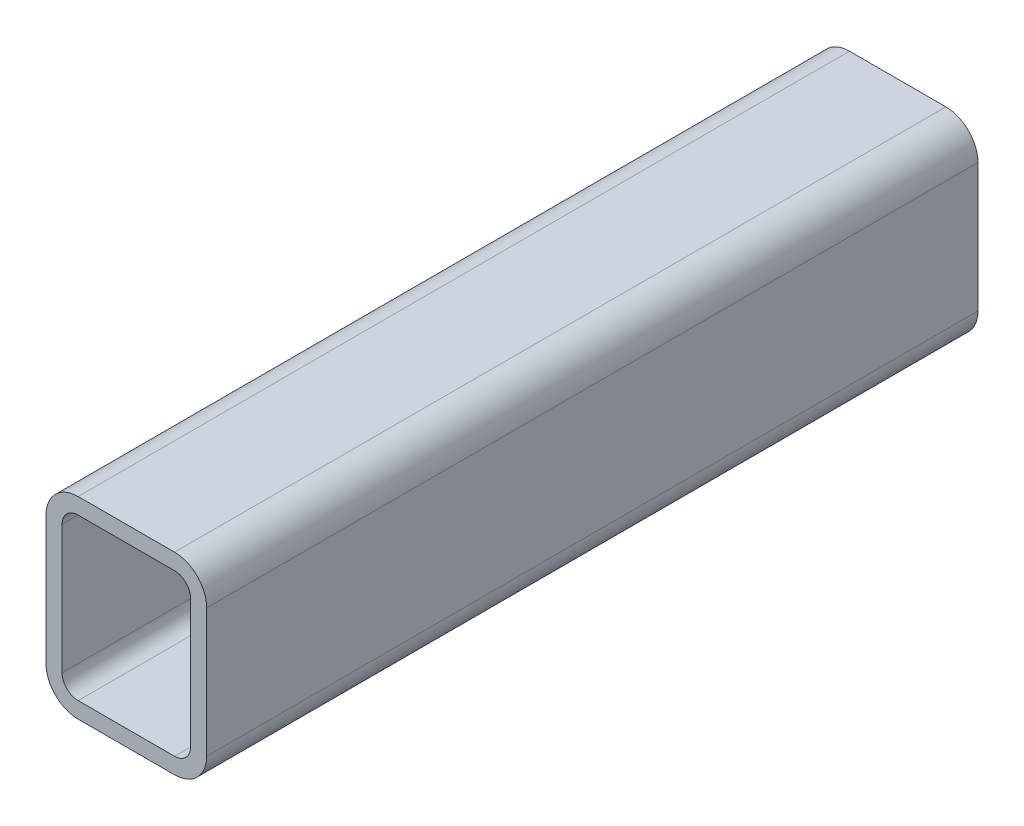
SolidWorks part; units mm, degrees
ref_plane "Front Plane" through (0, 0, 0) normal (0, 0, 1) x (1, 0, 0)
ref_plane "Top Plane" through (0, 0, 0) normal (0, 1, 0) x (1, 0, 0)
ref_plane "Right Plane" through (0, 0, 0) normal (1, 0, 0) x (0, 0, -1)
sketch "Sketch1" plane through (0, 0, 0) normal (0, 0, 1) x (1, 0, 0)
sketch_block_instance "HSS3x2.5x0.250-1"
sketch_block "HSS3x2.5x0.250"
extrude "Boss-Extrude1" add sketch "Sketch1" along normal blind 304.8
